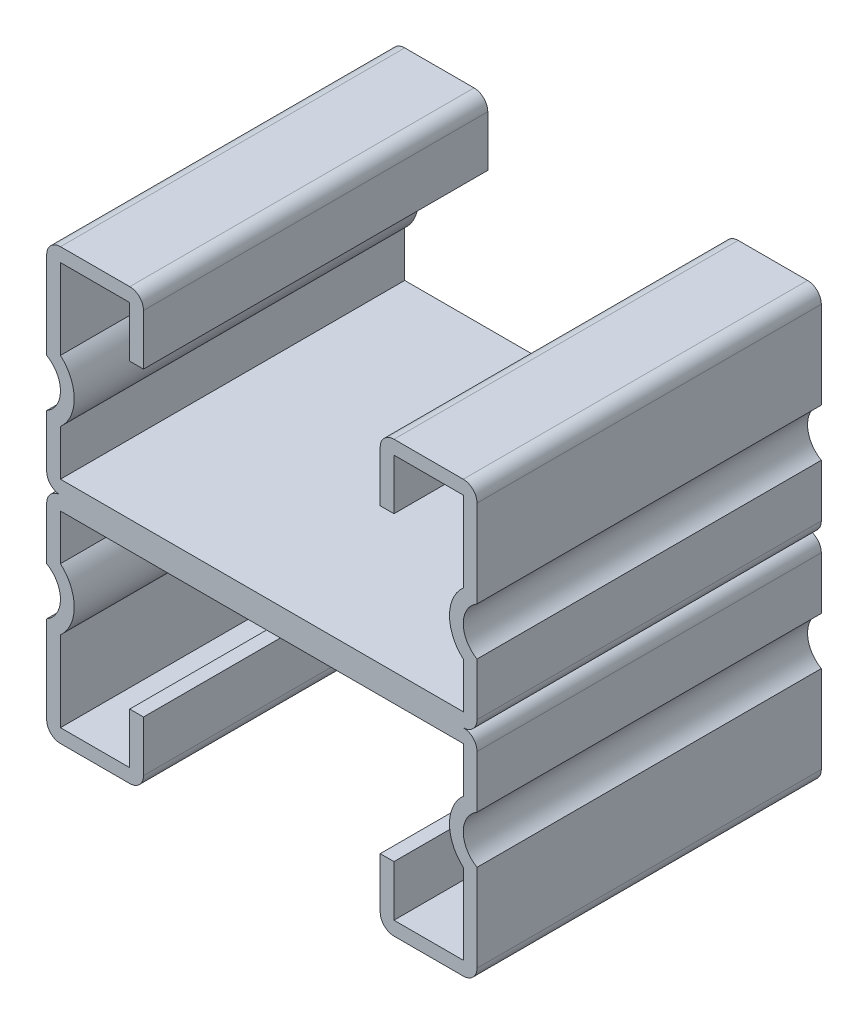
SolidWorks part; units mm, degrees
ref_plane "Plane1" through (0, 0, 0) normal (0, 0, 1) x (1, 0, 0)
ref_plane "Plane2" through (0, 0, 0) normal (0, 1, 0) x (1, 0, 0)
ref_plane "Plane3" through (0, 0, 0) normal (1, 0, 0) x (0, 0, -1)
sketch "Sketch1" plane through (0, 0, 0) normal (0, 0, 1) x (1, 0, 0)
  line L0 (-15.875, 14.859) -> (-15.875, 8.4146)
  line L1 (-15.875, 4.895) -> (-15.875, 1.016)
  line L2 (-14.859, 0) -> (14.859, 0)
  line L3 (15.875, 1.016) -> (15.875, 4.895)
  line L4 (15.875, 8.4146) -> (15.875, 14.859)
  line L5 (14.859, 15.875) -> (9.7472, 15.875)
  line L6 (8.7312, 14.859) -> (8.7312, 11.1125)
  line L7 (-14.859, 15.875) -> (-9.7473, 15.875)
  line L8 (-8.7313, 14.859) -> (-8.7313, 11.1125)
  line L9 (14.859, 2.6995) -> (14.859, 6.4516) construction
  line L10 (-14.859, 14.6685) -> (-14.859, 2.6995) construction
  line L11 (-9.7473, 14.859) -> (-9.7473, 11.1125)
  line L12 (-14.859, 14.859) -> (-9.7473, 14.859)
  line L13 (-14.859, 14.859) -> (-14.859, 8.9266)
  line L14 (-14.859, 4.383) -> (-14.859, 1.016)
  line L15 (-14.859, 1.016) -> (14.859, 1.016)
  line L16 (14.859, 1.016) -> (14.859, 4.383)
  line L17 (14.859, 8.9266) -> (14.859, 14.859)
  line L18 (14.859, 14.859) -> (9.7472, 14.859)
  line L19 (9.7472, 14.859) -> (9.7472, 11.1125)
  line L20 (-9.7473, 11.1125) -> (-8.7313, 11.1125)
  line L21 (8.7312, 11.1125) -> (9.7472, 11.1125)
  arc A0 (15.875, 8.4146) -> (15.875, 4.895) centre (16.891, 6.6548) ccw
  arc A1 (-15.875, 4.895) -> (-15.875, 8.4146) centre (-16.891, 6.6548) ccw
  arc A2 (-9.7473, 15.875) -> (-8.7313, 14.859) centre (-9.7473, 14.859) cw
  arc A3 (-15.875, 14.859) -> (-14.859, 15.875) centre (-14.859, 14.859) cw
  arc A4 (-14.859, 0) -> (-15.875, 1.016) centre (-14.859, 1.016) cw
  arc A5 (15.875, 1.016) -> (14.859, 0) centre (14.859, 1.016) cw
  arc A6 (14.859, 15.875) -> (15.875, 14.859) centre (14.859, 14.859) cw
  arc A7 (8.7312, 14.859) -> (9.7472, 15.875) centre (9.7472, 14.859) cw
  arc A8 (-14.859, 4.383) -> (-14.859, 8.9266) centre (-16.891, 6.6548) ccw
  arc A9 (14.859, 8.9266) -> (14.859, 4.383) centre (16.891, 6.6548) ccw
  dimension "D1" = 15.875
  dimension "D9" = 2.032
  dimension "D10" = 2.032
  dimension "D2" = 6.6548
  dimension "Width" = 31.75
  dimension "D6" = 17.4625
  dimension "edge" = 7.1437
  dimension "Lip" = 4.7625
  dimension "gauge" = 1.016
extrude "Base-Extrude" add sketch "Sketch1" along normal mid plane 25.4
mirror "Mirror1" about plane through (0, 0, 0) normal (0, 1, 0) of "Base-Extrude"
equation "\"D1@Sketch1\" = \"Width@Sketch1\" / 2"
equation "\"D6@Sketch1\" = \"Width@Sketch1\" - 2 * \"edge@Sketch1\""
equation "\"D10@Sketch1\" = 2 * \"gauge@Sketch1\""
equation "\"D9@Sketch1\" = \"D10@Sketch1\""
